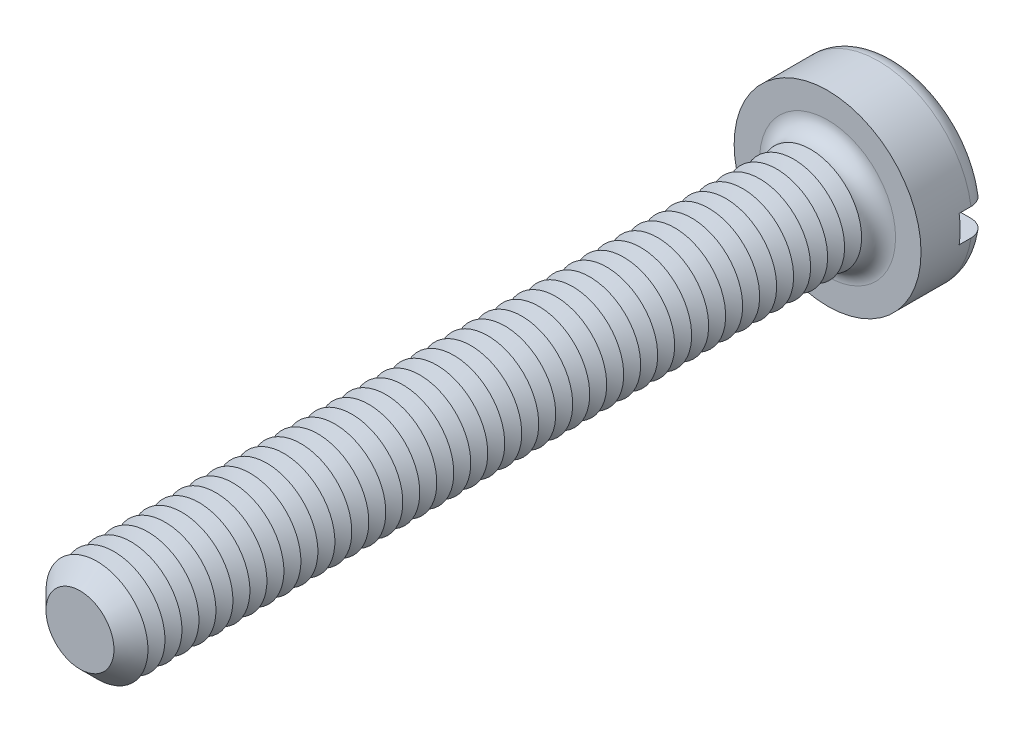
SolidWorks part; units mm, degrees
ref_plane "Front Plane" through (0, 0, 0) normal (0, 0, 1) x (1, 0, 0)
ref_plane "Top Plane" through (0, 0, 0) normal (0, 1, 0) x (1, 0, 0)
ref_plane "Right Plane" through (0, 0, 0) normal (1, 0, 0) x (0, 0, -1)
sketch "Sketch3" plane through (0, 0, 0) normal (0, 0, 1) x (1, 0, 0)
  circle A0 centre (0, 0) radius 2.75
  dimension "D1" = 5.5
extrude "Boss-Extrude2" add sketch "Sketch3" against normal blind 2
sketch "Sketch4" plane through (0, 0, 0) normal (0, 0, 1) x (1, 0, 0)
  circle A0 centre (0, 0) radius 1.5
  dimension "D1" = 3
extrude "Boss-Extrude3" add sketch "Sketch4" along normal blind 22
fillet "Fillet1" radius 0.5 2 edges at (2.75, 0, -2) (1.5, 0, 0)
chamfer "Chamfer1" distance 0.5 angle 45 1 edges at (1.5, 0, 22)
sketch "Sketch5" plane through (0, 0, 0) normal (1, 0, 0) x (0, 0, -1)
  line L0 (1.6944, 0) -> (-7.6738, 0) construction
sketch "Sketch6" plane through (0, 0, 0) normal (1, 0, 0) x (0, 0, -1)
  line L0 (-0.5, 1.5) -> (-0.75, 1.067)
  line L1 (-0.75, 1.067) -> (-1, 1.5)
  line L2 (-0.5, 1.5) -> (-21.5, 1.5) construction
  line L3 (-1, 1.5) -> (-0.5, 1.5)
  dimension "D1" = 0.5
revolve "Cut-Revolve1" cut sketch "Sketch6" angle 360 about L0
pattern_linear "LPattern1" count 42 spacing 0.5 along (0, 0, 1) of "Cut-Revolve1"
sketch "Sketch8" plane through (0, 0, -2) normal (0, 0, -1) x (-1, 0, 0)
  line L1 (2.75, -0.4) -> (-2.75, -0.4)
  line L2 (2.75, -0.4) -> (2.75, 0.4)
  line L3 (2.75, 0.4) -> (-2.75, 0.4)
  line L4 (-2.75, -0.4) -> (-2.75, 0.4)
  line L5 (2.75, -0.4) -> (-2.75, 0.4) construction
  line L6 (2.75, 0.4) -> (-2.75, -0.4) construction
  point P0 (0, 0)
  dimension "D1" = 5.5
  dimension "D2" = 0.8
extrude "Cut-Extrude1" cut sketch "Sketch8" against normal blind 0.85
